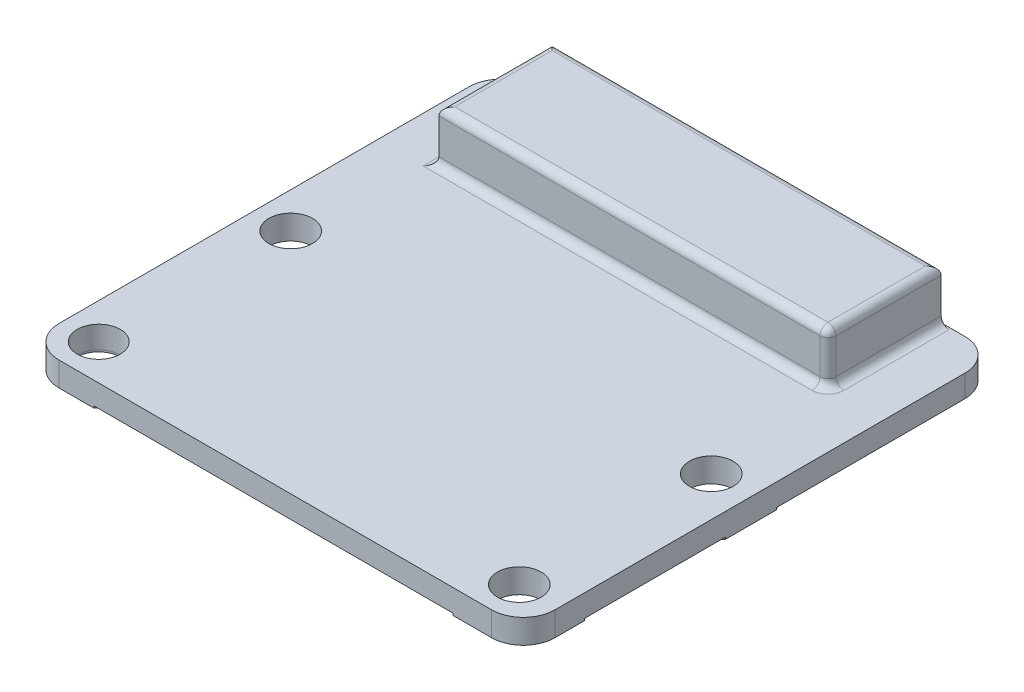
SolidWorks part; units mm, degrees
ref_plane "Ön Düzlem" through (0, 0, 0) normal (0, 0, 1) x (1, 0, 0)
ref_plane "Üst Düzlem" through (0, 0, 0) normal (0, 1, 0) x (1, 0, 0)
ref_plane "Sağ Düzlem" through (0, 0, 0) normal (1, 0, 0) x (0, 0, -1)
sketch "Çizim1" plane through (0, 0, 0) normal (0, 1, 0) x (1, 0, 0)
  line L1 (-12.5, 11.931) -> (12.5, 11.931)
  line L2 (-12.5, 11.931) -> (-12.5, -11.931)
  line L3 (-12.5, -11.931) -> (12.5, -11.931)
  line L4 (12.5, 11.931) -> (12.5, -11.931)
  line L5 (-12.5, 11.931) -> (12.5, -11.931) construction
  line L6 (-12.5, -11.931) -> (12.5, 11.931) construction
  circle A0 centre (-10.7, -0.456) radius 1.1
  circle A1 centre (-10.7, -10.131) radius 1.0852
  arc A2 (-12.5, -11.6804) -> (-12.2494, -11.931) centre (-10.7, -10.131) ccw construction
  arc A3 (-12.5, -2.0054) -> (-12.5, 1.0934) centre (-10.7, -0.456) ccw construction
  circle A4 centre (10.5, -0.456) radius 1.1
  circle A5 centre (10.5, -0.456) radius 2.375 construction
  circle A6 centre (10.5, -10.131) radius 1.1
  arc A7 (12.5, -8.8501) -> (12.5, -11.4119) centre (10.5, -10.131) ccw construction
  arc A8 (-9.1506, -11.931) -> (-12.5, -8.5816) centre (-10.7, -10.131) ccw construction
  point P0 (0, 0)
  point P20 (-10.7, -2.831)
  dimension "D3" = 2.2
  dimension "D4" = 4.75
  dimension "D5" = 4.75
  dimension "D1" = 25
  dimension "D2" = 23.862
  dimension "D6" = 1.8
  dimension "D7" = 2
  dimension "D8" = 7.3
  dimension "D9" = 1.8
extrude "Yükseklik-Ekstrüzyon1" add sketch "Çizim1" along normal blind 1.12
sketch "Çizim3" plane through (0, 0, 0) normal (0, -1, 0) x (1, 0, 0)
  line L1 (-5.4, 2.831) -> (5.4, 2.831)
  line L2 (-5.4, 2.831) -> (-5.4, -7.969)
  line L3 (-5.4, -7.969) -> (5.4, -7.969)
  line L4 (5.4, 2.831) -> (5.4, -7.969)
  line L5 (-5.4, 2.831) -> (5.4, -7.969) construction
  line L6 (-5.4, -7.969) -> (5.4, 2.831) construction
  point P0 (0, -2.569)
  point P11 (-10.7, 10.131)
  dimension "D1" = 10.8
  dimension "D2" = 10.8
  dimension "D3" = 7.3
extrude "Yükseklik-Ekstrüzyon2" add sketch "Çizim3" along normal blind 4.07
sketch "Çizim4" plane through (0, 0, 0) normal (0, -1, 0) x (1, 0, 0)
  line L0 (-12.5, 11.931) -> (-9.1506, 11.931)
  line L2 (-12.5, 11.931) -> (-12.5, 8.5816)
  line L4 (-12.5, 2.0054) -> (-12.5, -1.0934)
  line L5 (12.5, 1.7369) -> (12.5, -0.8249)
  line L7 (12.5, 8.8501) -> (12.5, 11.931)
  line L8 (12.5, 11.931) -> (8.9506, 11.931)
  arc A0 (-12.5, 8.5816) -> (-9.1506, 11.931) centre (-10.7, 10.131) ccw
  arc A1 (-12.5, -1.0934) -> (-12.5, 2.0054) centre (-10.7, 0.456) ccw
  arc A2 (12.5, 1.7369) -> (12.5, -0.8249) centre (10.5, 0.456) ccw
  arc A3 (8.9506, 11.931) -> (12.5, 8.8501) centre (10.5, 10.131) ccw
  circle A4 centre (-10.7, 0.456) radius 1.1
  circle A5 centre (-10.7, 10.131) radius 1.1
  circle A6 centre (10.5, 10.131) radius 1.1
  circle A7 centre (10.5, 0.456) radius 1.1
  dimension "D1" = 4.75
  dimension "D3" = 2.2
  dimension "D2" = 3.5494
extrude "Yükseklik-Ekstrüzyon3" add sketch "Çizim4" along normal blind 0.1
sketch "Çizim6" plane through (0, 0, 0) normal (0, -1, 0) x (1, 0, 0)
  line L0 (12.5, 8.8501) -> (12.5, 1.7369) construction
  line L1 (-6.5, 9.231) -> (2.5, 9.231)
  line L2 (-6.5, 9.231) -> (-6.5, 4.631)
  line L3 (-6.5, 4.631) -> (2.5, 4.631)
  line L4 (2.5, 9.231) -> (2.5, 4.631)
  line L5 (5.4, 2.831) -> (-5.4, 2.831) construction
  dimension "D1" = 9
  dimension "D2" = 4.6
  dimension "D3" = 10
  dimension "D4" = 1.8
extrude "Yükseklik-Ekstrüzyon4" add sketch "Çizim6" along normal blind 0.5
sketch "Çizim7" plane through (0, -4.07, 0) normal (0, -1, 0) x (1, 0, 0)
  line L0 (5.4, 2.831) -> (-5.4, 2.831) construction
  line L5 (5.4, -7.969) -> (5.4, 2.831) construction
  circle A4 centre (0, -2.569) radius 3.475
  point P4 (0, 2.831)
  point P5 (0, 0.906)
  point P9 (5.4, -2.569)
  dimension "D1" = 6.95
sketch "Çizim8" plane through (0, -4.07, 0) normal (0, -1, 0) x (1, 0, 0)
  line L0 (-5.4, 2.831) -> (-3.4, 2.831)
  line L1 (5.4, 2.831) -> (-5.4, 2.831) construction
  line L2 (-3.4, 2.831) -> (-5.4, 0.831)
  line L3 (-5.4, 2.831) -> (-5.4, -7.969) construction
  line L4 (-5.4, 0.831) -> (-5.4, 2.831)
  line L5 (5.4, 2.831) -> (3.4, 2.831)
  line L6 (5.4, 2.831) -> (-5.4, 2.831) construction
  line L7 (3.4, 2.831) -> (5.4, 0.831)
  line L8 (5.4, -7.969) -> (5.4, 2.831) construction
  line L9 (5.4, 0.831) -> (5.4, 2.831)
  line L10 (5.4, -7.969) -> (3.4, -7.969)
  line L11 (-5.4, -7.969) -> (5.4, -7.969) construction
  line L12 (3.4, -7.969) -> (5.4, -5.969)
  line L13 (5.4, -7.969) -> (5.4, 2.831) construction
  line L14 (5.4, -5.969) -> (5.4, -7.969)
  line L15 (-5.4, -7.969) -> (-3.4, -7.969)
  line L16 (-3.4, -7.969) -> (-5.4, -5.969)
  line L17 (-5.4, -5.969) -> (-5.4, -7.969)
  dimension "D1" = 2
  dimension "D2" = 2
  dimension "D3" = 2
  dimension "D4" = 2
  dimension "D5" = 2
  dimension "D6" = 2
  dimension "D7" = 2
  dimension "D8" = 2
extrude "Kes-Ekstrüzyon1" cut sketch "Çizim8" against normal blind 1
fillet "Radyus1" radius 0.2 24 edges at (-5.4, -3.57, 0.831) (-3.4, -3.57, 2.831) (3.4, -3.57, 2.831) (5.4, -3.57, 0.831) (5.4, -3.57, -5.969) (-5.4, -3.07, -6.969) (-4.4, -3.07, -7.969) (-4.4, -4.07, 1.831) (-5.4, -3.07, 1.831) (-4.4, -3.07, 2.831) (-4.4, -3.07, 1.831) (4.4, -4.07, 1.831) (4.4, -3.07, 2.831) (5.4, -3.07, 1.831) (4.4, -3.07, 1.831) (3.4, -3.57, -7.969) (4.4, -4.07, -6.969) (5.4, -3.07, -6.969) (4.4, -3.07, -7.969) (4.4, -3.07, -6.969) (-4.4, -4.07, -6.969) (-5.4, -3.57, -5.969) (-3.4, -3.57, -7.969) (-4.4, -3.07, -6.969)
extrude "Yükseklik-Ekstrüzyon5" add sketch "Çizim7" along normal blind 4.23
sketch "Çizim9" plane through (0, -8.3, 0) normal (0, -1, 0) x (1, 0, 0)
  circle A0 centre (0, -2.569) radius 2.5
  dimension "D1" = 5
extrude "Kes-Ekstrüzyon2" cut sketch "Çizim9" against normal blind 2
sketch "Çizim10" plane through (0, 0, 0) normal (1, 0, 0) x (0, 0, -1)
  line L0 (0.069, -6.3) -> (5.069, -6.3) construction
  line L1 (0.069, -6.3) -> (2.569, -6.3)
  line L2 (2.569, -6.3) -> (2.569, -8.8)
  arc A0 (0.069, -6.3) -> (2.569, -8.8) centre (2.569, -6.3) ccw
  point P3 (2.569, -6.3)
  point P6 (2.8338, -8.1723)
  dimension "D2" = 2.5
  dimension "D1" = 2.5
revolve "Döndür1" add sketch "Çizim10" angle 360 about L2
fillet "Radyus2" radius 1.6 4 edges at (12.5, 0.56, -11.931) (-12.5, 0.56, -11.931) (-12.5, 0.51, 11.931) (12.5, 0.51, 11.931)
sketch "Çizim11" plane through (0, 1.12, 0) normal (0, 1, 0) x (1, 0, 0)
  line L1 (-9.805, 11.831) -> (9.805, 11.831)
  line L2 (-9.805, 11.831) -> (-9.805, 6.121)
  line L3 (-9.805, 6.121) -> (9.805, 6.121)
  line L4 (9.805, 11.831) -> (9.805, 6.121)
  line L5 (10.9, 11.931) -> (-10.9, 11.931) construction
  point P6 (0, 6.121)
  dimension "D1" = 5.71
  dimension "D2" = 19.61
  dimension "D3" = 0.1
extrude "Yükseklik-Ekstrüzyon6" add sketch "Çizim11" along normal blind 2.58
sketch "Çizim12" plane through (0, 0, -11.831) normal (0, 0, -1) x (-1, 0, 0)
  line L0 (-9.805, 3.7) -> (-9.805, 1.12) construction
  line L1 (-9, 2.91) -> (9, 2.91)
  line L2 (-9, 2.91) -> (-9, 1.91)
  line L3 (-9, 1.91) -> (9, 1.91)
  line L4 (9, 2.91) -> (9, 1.91)
  point P4 (0, 1.91)
  point P6 (-9.805, 2.41)
  point P7 (-9, 2.41)
  dimension "D1" = 1
  dimension "D2" = 18
extrude "Kes-Ekstrüzyon3" cut sketch "Çizim12" against normal blind 2
fillet "Radyus3" radius 0.4 1 edges at (0, 2.91, -11.831)
fillet "Radyus4" radius 0.4 8 edges at (0, 3.7, -11.831) (-9.805, 3.7, -8.976) (9.805, 3.7, -8.976) (0, 3.7, -6.121) (9.805, 2.41, -6.121) (9.805, 1.12, -8.976) (0, 1.12, -6.121) (-9.805, 1.12, -8.976)
sketch "Çizim13" plane through (0, 0, 0) normal (1, 0, 0) x (0, 0, -1)
  line L0 (9.831, 1.91) -> (9.831, 2.91) construction
  line L1 (9.831, 1.91) -> (11.831, 1.91) construction
  line L2 (11.531, 1.91) -> (11.831, 1.91)
  line L3 (9.831, 2.21) -> (9.831, 2.37)
  arc A0 (11.531, 1.91) -> (9.831, 2.21) centre (9.1241, -6.7622) ccw
  arc A1 (11.831, 1.91) -> (9.831, 2.37) centre (9.0526, -5.592) ccw
  dimension "D2" = 9
  dimension "D4" = 8
  dimension "D1" = 0.3
  dimension "D3" = 0.3
  dimension "D5" = 0.16
extrude "Yükseklik-Ekstrüzyon7" add sketch "Çizim13" along normal mid plane 0.5
pattern_linear "LÇoğaltma1" count 9 spacing 1 along (1, 0, 0) of "Yükseklik-Ekstrüzyon7"
pattern_linear "LÇoğaltma2" count 9 spacing 1 along (-1, 0, 0) of "Yükseklik-Ekstrüzyon7"
